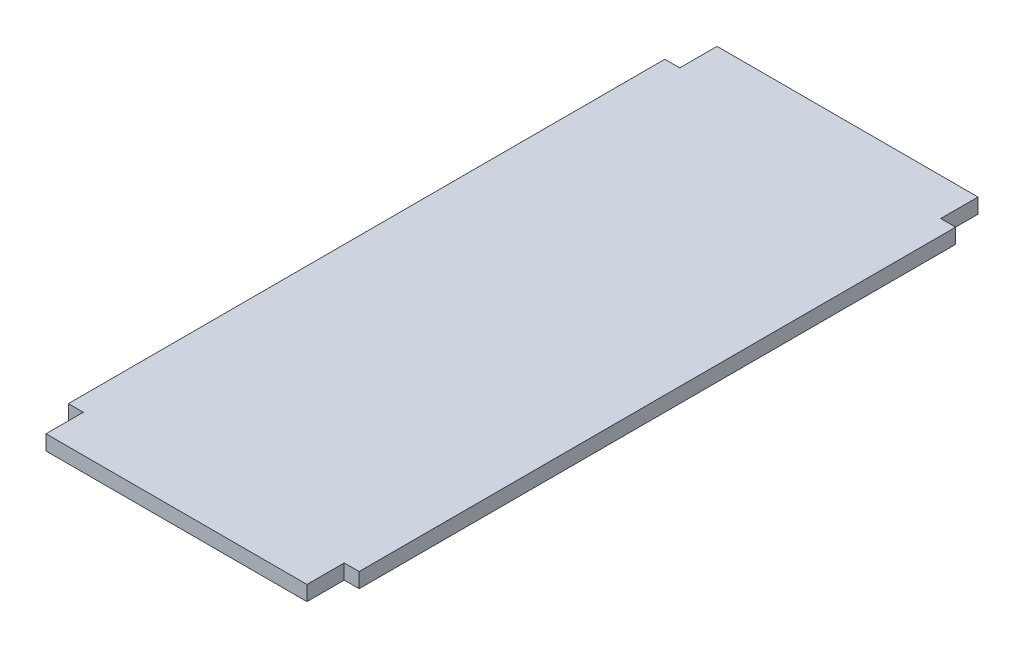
SolidWorks part; units mm, degrees
ref_plane "Front" through (0, 0, 0) normal (0, 0, 1) x (1, 0, 0)
ref_plane "Top" through (0, 0, 0) normal (0, 1, 0) x (1, 0, 0)
ref_plane "Right" through (0, 0, 0) normal (1, 0, 0) x (0, 0, -1)
sketch "草图1" plane through (0, 0, 0) normal (0, 1, 0) x (1, 0, 0)
  line L1 (0, 0) -> (35, 0)
  line L2 (0, 0) -> (0, 90)
  line L3 (0, 90) -> (35, 90)
  line L4 (35, 0) -> (35, 90)
  line L5 (0, 85) -> (-2, 85)
  line L6 (0, 85) -> (0, 5)
  line L7 (0, 5) -> (-2, 5)
  line L8 (-2, 85) -> (-2, 5)
  line L9 (35, 85) -> (37, 85)
  line L10 (35, 85) -> (35, 5)
  line L11 (35, 5) -> (37, 5)
  line L12 (37, 85) -> (37, 5)
  dimension "D1" = 2
  dimension "D2" = 2
  dimension "D3" = 35
  dimension "D4" = 80
  dimension "D5" = 90
  dimension "D6" = 5
  dimension "D7" = 5
  dimension "D8" = 80
extrude "凸台-拉伸1" add sketch "草图1" along normal blind 2 contours L1 L4 L3 L2 | L12 L9 L4 L11 | L8 L7 L6 L5
